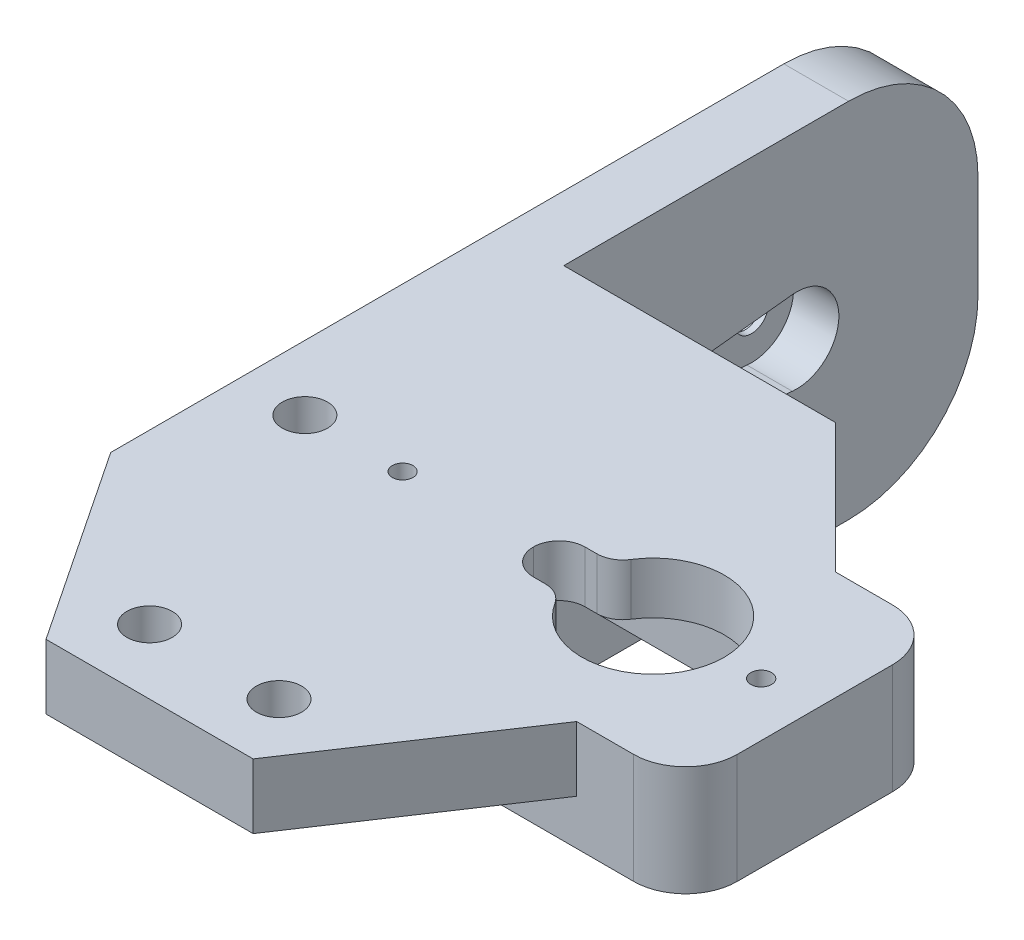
SolidWorks part; units mm, degrees
ref_plane "前视基准面" through (0, 0, 0) normal (0, 0, 1) x (1, 0, 0)
ref_plane "上视基准面" through (0, 0, 0) normal (0, 1, 0) x (1, 0, 0)
ref_plane "右视基准面" through (0, 0, 0) normal (1, 0, 0) x (0, 0, -1)
imported_body "输入1"
sketch "草图1" plane through (0, 3.5, 0) normal (0, -1, 0) x (1, 0, 0)
  circle A0 centre (31.9, -25) radius 5.5
  dimension "D1" = 11
extrude "切除-拉伸1" cut sketch "草图1" against normal blind 10
other "移动面1" parameters "D1"=2.5
sketch "草图2" plane through (0, 5, 0) normal (0, 1, 0) x (1, 0, 0)
  line L0 (23.1457, 25) -> (23.1457, 22.0194) construction
  line L1 (30.1543, 27) -> (22.6457, 27)
  line L2 (30.1543, 27) -> (30.1543, 23)
  line L3 (30.1543, 23) -> (22.6457, 23)
  line L4 (22.6457, 27) -> (22.6457, 23)
  line L5 (30.1543, 27) -> (22.6457, 23) construction
  line L6 (30.1543, 23) -> (22.6457, 27) construction
  arc A1 (25.1311, 26.739) -> (25.1311, 23.261) centre (24.9, 25) ccw construction
  point P3 (26.4, 25)
  dimension "D1" = 4
  dimension "D2" = 0.5
extrude "切除-拉伸2" cut sketch "草图2" against normal blind 10
fillet "圆角1" radius 2 4 edges at (22.6457, 3, -27) (22.6457, 3, -23) (26.7765, 3, -23) (26.7765, 3, -27)
sketch "草图3" plane through (0, -5.5, 0) normal (0, -1, 0) x (-1, 0, 0)
  line L0 (-5, 43) -> (-5, 33) construction
  line L1 (-46.675, 39.3057) -> (-5, 39.3057)
  line L2 (-46.675, 39.3057) -> (-46.675, 12.5707)
  line L3 (-46.675, 12.5707) -> (-5, 12.5707)
  line L4 (-5, 39.3057) -> (-5, 12.5707)
  line L5 (-46.675, 39.3057) -> (-5, 12.5707) construction
  line L6 (-46.675, 12.5707) -> (-5, 39.3057) construction
  point P4 (-25.8375, 25.9382)
extrude "切除-拉伸3" cut sketch "草图3" against normal blind 2
sketch "草图4" plane through (0, -3.5, 0) normal (0, -1, 0) x (1, 0, 0)
  circle A0 centre (40.7, -25) radius 1.876
  circle A1 centre (13.1, -25) radius 1.892
extrude "凸台-拉伸1" add sketch "草图4" against normal up to surface (8.5 mm away)
sketch "草图5" plane through (0, -3.5, 0) normal (0, -1, 0) x (1, 0, 0)
  line L0 (15.4, -31.5) -> (15.4, -18.5) construction
  line L1 (38.4, -31.5) -> (14.4, -31.5)
  line L2 (38.4, -31.5) -> (38.4, -18.5)
  line L3 (38.4, -18.5) -> (14.4, -18.5)
  line L4 (14.4, -31.5) -> (14.4, -18.5)
  line L5 (38.4, -31.5) -> (14.4, -18.5) construction
  line L6 (38.4, -18.5) -> (14.4, -31.5) construction
  line L7 (15.4, -18.5) -> (38.4, -18.5) construction
  point P4 (26.4, -25)
  dimension "D1" = 1
extrude "切除-拉伸4" cut sketch "草图5" against normal up to surface (4.5 mm away)
hole_wizard "M2 螺纹孔1" positions "草图10" profile "草图9" tap size "M2" standard "GB"
sketch "草图10" plane through (0, -3.5, 0) normal (0, -1, 0) x (-1, 0, 0)
  point P0 (-40.25, 25)
  point P3 (-12.55, 25)
sketch "草图9" plane through (40.25, -3.5, -25) normal (1, 0, 0) x (0, 0, -1)
  line L0 (0, 0) -> (0, 8.5)
  line L1 (0, 8.5) -> (0.8, 8.5)
  line L2 (0.8, 8.5) -> (0.8, 0)
  line L5 (0.8, 0) -> (0, 0)
  line L11 (0, -6.35) -> (0, 107.95) construction
  dimension "通孔螺纹孔钻头直径" = 1.6
  dimension "通孔螺纹孔钻头深度" = 8.5
fillet "圆角3" radius 5 1 edges at (9.4, -1.75, -33)
fillet "圆角5" radius 8 1 edges at (5, -1.75, -35)
equation "\"Dummy1\"= \"零件图号代码\""
equation "\"Dummy2\"= \"产品名称代码\""
